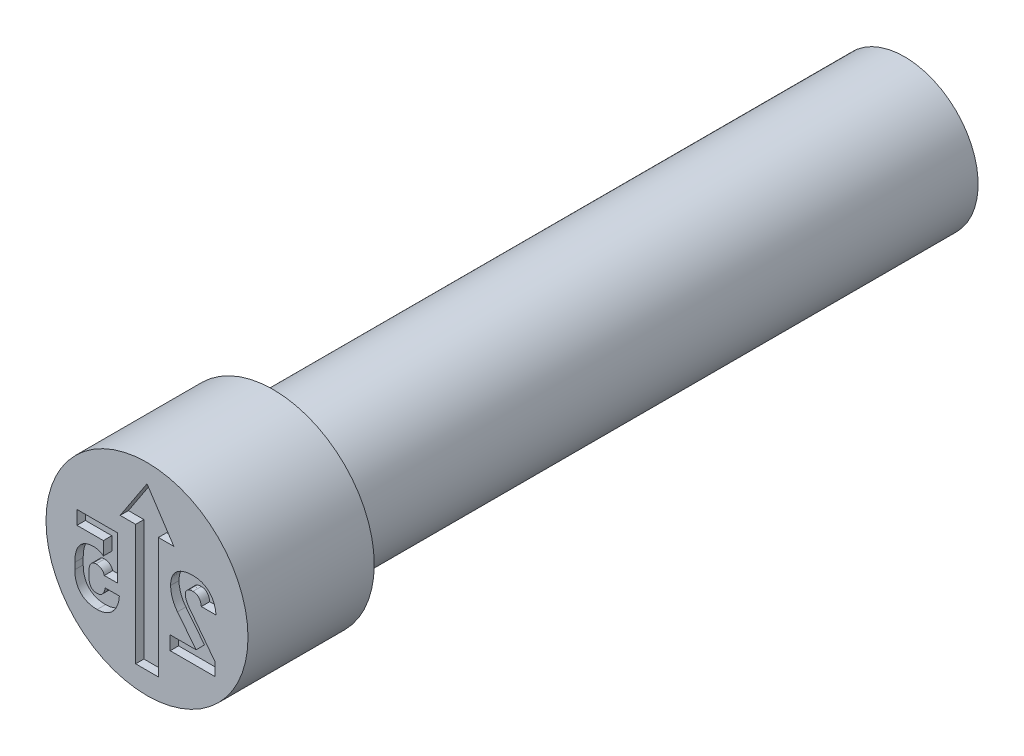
SolidWorks part; units mm, degrees
ref_plane "Front Plane" through (0, 0, 0) normal (0, 0, 1) x (1, 0, 0)
ref_plane "Top Plane" through (0, 0, 0) normal (0, 1, 0) x (1, 0, 0)
ref_plane "Right Plane" through (0, 0, 0) normal (1, 0, 0) x (0, 0, -1)
imported_body "Imported1"
sketch "Sketch1" plane through (0, 0, -0.4267) normal (0, 0, 1) x (1, 0, 0)
  line L7 (0.6385, 0.9906) -> (0, 1.9597)
  line L8 (0, 1.9597) -> (-0.6385, 0.9906)
  line L9 (-0.6385, 0.9906) -> (-0.27, 0.9906)
  line L10 (-0.27, 0.9906) -> (-0.27, -1.88)
  line L11 (-0.27, -1.88) -> (0.27, -1.88)
  line L12 (0.27, -1.88) -> (0.27, 0.9906)
  line L13 (0.27, 0.9906) -> (0.6385, 0.9906)
  line L14 (0.6385, 0.9906) -> (0, 1.9597)
  line L15 (0, 1.9597) -> (-0.6385, 0.9906)
  line L16 (-0.6385, 0.9906) -> (-0.27, 0.9906)
  line L17 (-0.27, 0.9906) -> (-0.27, -1.88)
  line L18 (-0.27, -1.88) -> (0.27, -1.88)
  line L19 (0.27, -1.88) -> (0.27, 0.9906)
  line L20 (0.27, 0.9906) -> (0.6385, 0.9906)
  dimension "D1" = 0
extrude "Boss-Extrude1" add sketch "Sketch1" along normal blind 0.23
sketch "Sketch2" plane through (0, 0, 0) normal (0, 0, 1) x (1, 0, 0)
  text T0 "2  5" font "Bahnschrift" height 1.8
  dimension "D1" = 1.75
  dimension "D2" = 1.2
extrude "Cut-Extrude1" cut sketch "Sketch2" against normal blind 0.2
